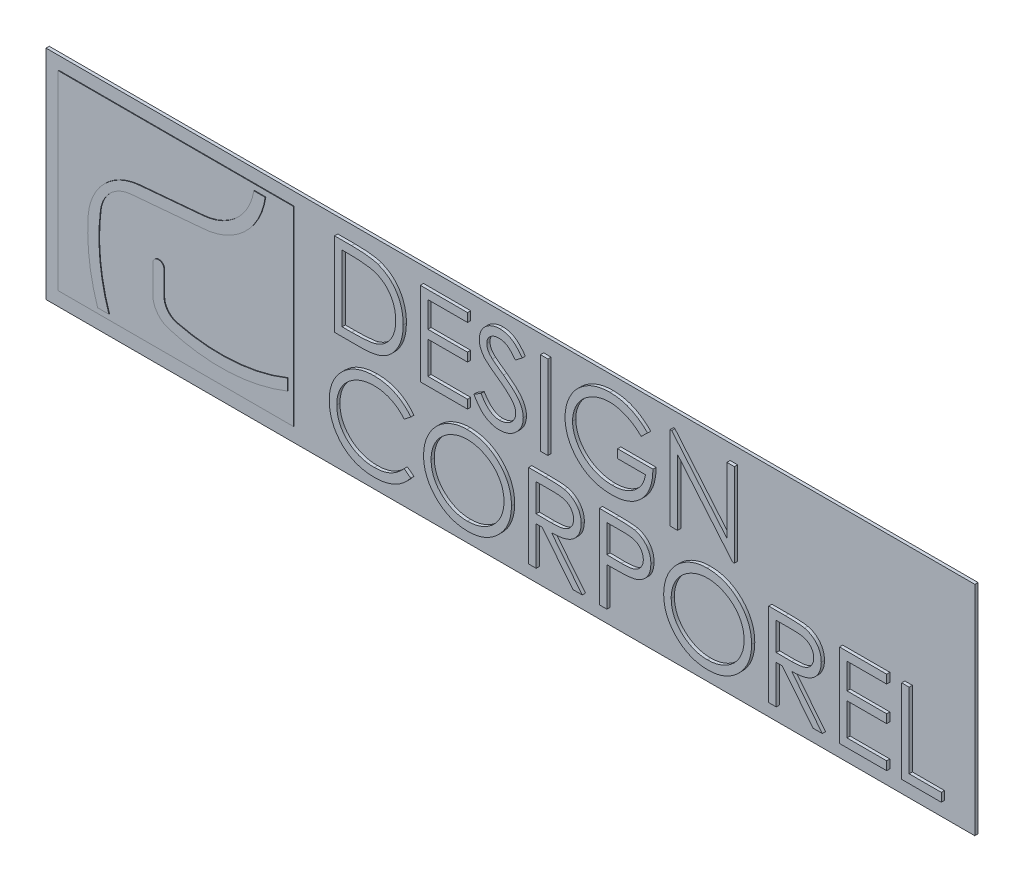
SolidWorks part; units mm, degrees
ref_plane "Plan de face" through (0, 0, 0) normal (0, 0, 1) x (1, 0, 0)
ref_plane "Plan de dessus" through (0, 0, 0) normal (0, 1, 0) x (1, 0, 0)
ref_plane "Plan de droite" through (0, 0, 0) normal (1, 0, 0) x (0, 0, -1)
imported_body "Imported216-1-solid1"
imported_body "Imported217-1-solid1"
imported_body "Imported218-1-solid1"
sketch "Esquisse1" plane through (0, 0, 6.8) normal (0, 0, -1) x (-1, 0, 0)
  line L0 (-96.9706, 129.4073) -> (-170.4706, 129.4073) construction
  line L1 (-92.9706, 65.4073) -> (-382.9706, 65.4073)
  line L2 (-92.9706, 65.4073) -> (-92.9706, 133.4073)
  line L3 (-92.9706, 133.4073) -> (-382.9706, 133.4073)
  line L4 (-382.9706, 65.4073) -> (-382.9706, 133.4073)
  line L5 (-96.9706, 69.9073) -> (-96.9706, 129.4073) construction
  dimension "D1" = 68
  dimension "D2" = 4
  dimension "D3" = 4
  dimension "D4" = 290
extrude "Extrusion1" add sketch "Esquisse1" along normal blind 1
sketch "Esquisse2" plane through (0, 0, 6.8) normal (0, 0, 1) x (1, 0, 0)
  text T0 "DESIGN" font "Century Gothic" height in points 74
extrude "Extrusion2" add sketch "Esquisse2" along normal blind 1
sketch "Esquisse4" plane through (0, 0, 6.8) normal (0, 0, 1) x (1, 0, 0)
  text T0 "CORPOREL" font "Century Gothic" height in points 74
extrude "Extrusion3" add sketch "Esquisse4" along normal blind 1
